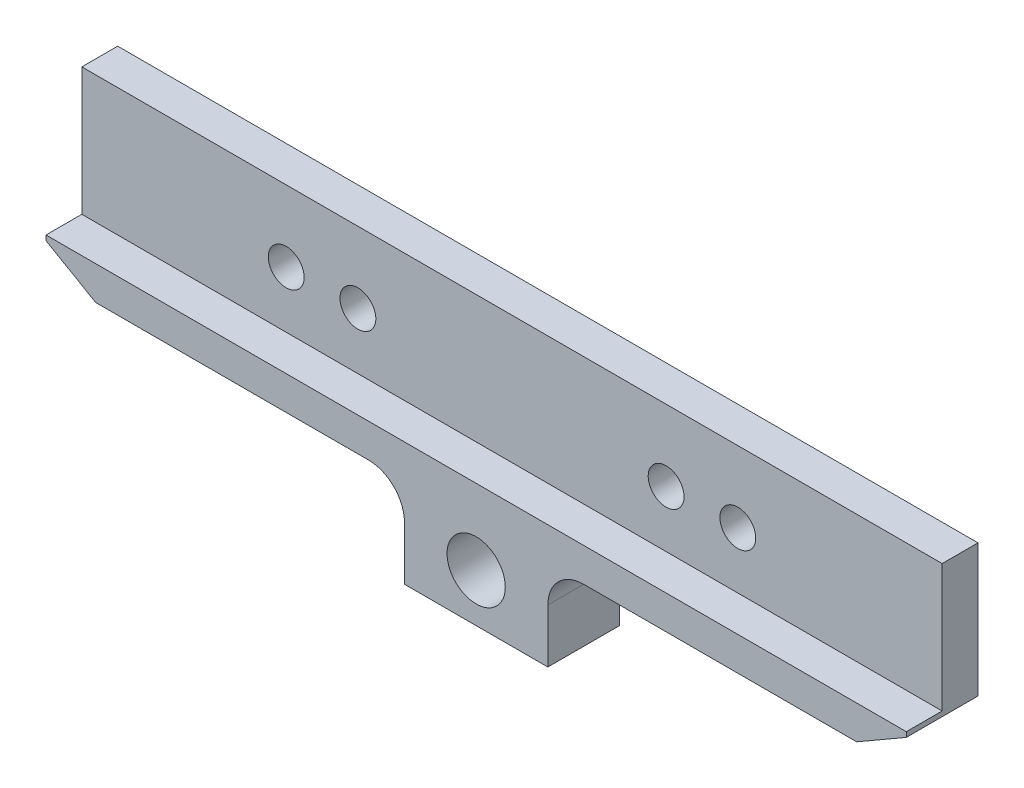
SolidWorks part; units mm, degrees
ref_plane "Front" through (0, 0, 0) normal (0, 0, 1) x (1, 0, 0)
ref_plane "Top" through (0, 0, 0) normal (0, 1, 0) x (1, 0, 0)
ref_plane "Right" through (0, 0, 0) normal (1, 0, 0) x (0, 0, -1)
sketch "Sketch1" plane through (0, 0, 0) normal (0, 0, 1) x (1, 0, 0)
  line L0 (-38.1, 0) -> (38.1, 0)
  line L1 (-38.1, 0) -> (-38.1, -14.8533)
  line L2 (38.1, 0) -> (38.1, -14.8533)
  line L3 (0, 0) -> (0, -25.4) construction
  arc A0 (-38.1, -14.8533) -> (38.1, -14.8533) centre (0, 48.6918) ccw
  circle A1 centre (0, -17.9832) radius 2.5794
  circle A2 centre (13.65, -6.3082) radius 1.5881
  circle A3 centre (20, -6.3082) radius 1.5881
  circle A4 centre (-20, -6.3082) radius 1.5881
  circle A5 centre (-13.65, -6.3082) radius 1.5881
  dimension "D1" = 148.1836
  dimension "D3" = 5.1587
  dimension "D6" = 3.1763
  dimension "D2" = 25.4
  dimension "D4" = 66.675
  dimension "D5" = 38.1
  dimension "D7" = 6.3082
  dimension "D8" = 20
  dimension "D9" = 20
  dimension "D10" = 6.35
  dimension "D11" = 33.65
extrude "Boss-Extrude1" add sketch "Sketch1" along normal mid plane 6.35
sketch "Sketch2" plane through (0, 0, 3.175) normal (0, 0, 1) x (1, 0, 0)
  line L1 (40, -11.3082) -> (-40, -11.3082)
  line L2 (38.1, 0) -> (-38.1, 0) construction
  line L3 (-40, -11.3082) -> (-40, 5.1343)
  line L4 (-40, 5.1343) -> (40, 5.1343)
  line L5 (40, 5.1343) -> (40, -11.3082)
  dimension "D1" = 11.3082
extrude "Cut-Extrude1" cut sketch "Sketch2" against normal blind 3.175
sketch "Sketch3" plane through (0, 0, -3.175) normal (0, 0, -1) x (-1, 0, 0)
  line L0 (0, 0) -> (0, -28.4602) construction
  line L1 (-42.9143, -17.46) -> (-19.05, -17.46)
  line L2 (-42.9143, -17.46) -> (-42.9143, -31.0618)
  line L3 (-42.9143, -31.0618) -> (-19.05, -31.0618)
  line L4 (-19.05, -17.46) -> (-19.05, -31.0618)
  line L5 (-12.7, -27.6457) -> (-6.35, -27.6457)
  line L6 (-12.7, -27.6457) -> (-12.7, -20.8855)
  line L7 (-12.7, -20.8855) -> (-6.35, -20.8855)
  line L8 (-6.35, -27.6457) -> (-6.35, -20.8855)
  line L9 (-38.1, 0) -> (38.1, 0) construction
  line L10 (6.35, -27.6457) -> (6.35, -20.8855)
  line L11 (12.7, -20.8855) -> (6.35, -20.8855)
  line L12 (12.7, -27.6457) -> (12.7, -20.8855)
  line L13 (12.7, -27.6457) -> (6.35, -27.6457)
  line L14 (19.05, -17.46) -> (19.05, -31.0618)
  line L15 (42.9143, -31.0618) -> (19.05, -31.0618)
  line L16 (42.9143, -17.46) -> (42.9143, -31.0618)
  line L17 (42.9143, -17.46) -> (19.05, -17.46)
  dimension "D1" = 6.35
  dimension "D2" = 6.35
  dimension "D3" = 6.35
  dimension "D4" = 17.46
extrude "Cut-Extrude2" cut sketch "Sketch3" against normal through all
fillet "Fillet2" radius 1.5875 6 edges at (-19.05, -17.46, 0) (-6.35, -20.8855, 0) (12.7, -20.8855, 0) (-12.7, -20.8855, 0) (6.35, -20.8855, 0) (19.05, -17.46, 0)
sketch "Sketch4" plane through (0, 0, -3.175) normal (0, 0, -1) x (-1, 0, 0)
  line L13 (19.05, -22.9091) -> (19.05, -19.0475)
  line L14 (20.6375, -17.46) -> (33.3697, -17.46)
  line L15 (38.1, -14.8533) -> (38.1, 0)
  line L16 (38.1, 0) -> (-38.1, 0)
  line L17 (-38.1, 0) -> (-38.1, -14.8533)
  line L18 (-33.3697, -17.46) -> (-20.6375, -17.46)
  line L19 (-19.05, -19.0475) -> (-19.05, -22.9091)
  line L20 (-12.7, -24.3034) -> (-12.7, -22.473)
  line L21 (-11.1125, -20.8855) -> (-7.9375, -20.8855)
  line L22 (-6.35, -22.473) -> (-6.35, -25.1274)
  line L23 (6.35, -25.1274) -> (6.35, -22.473)
  line L24 (7.9375, -20.8855) -> (11.1125, -20.8855)
  line L25 (12.7, -22.473) -> (12.7, -24.3034)
  line L26 (19.05, -22.9091) -> (19.05, -19.0475)
  line L27 (20.6375, -17.46) -> (33.3697, -17.46)
  line L31 (-33.3697, -17.46) -> (-20.6375, -17.46)
  line L32 (-19.05, -19.0475) -> (-19.05, -22.9091)
  line L33 (-12.7, -24.3034) -> (-12.7, -22.473)
  line L34 (-11.1125, -20.8855) -> (-7.9375, -20.8855)
  line L35 (-6.35, -22.473) -> (-6.35, -25.1274)
  line L36 (6.35, -25.1274) -> (6.35, -22.473)
  line L37 (7.9375, -20.8855) -> (11.1125, -20.8855)
  line L38 (12.7, -22.473) -> (12.7, -24.3034)
  arc A0 (-33.3697, -17.46) -> (-19.05, -22.9091) centre (0, 48.6918) ccw
  arc A1 (-12.7, -24.3034) -> (-6.35, -25.1274) centre (0, 48.6918) ccw
  arc A2 (6.35, -25.1274) -> (12.7, -24.3034) centre (0, 48.6918) ccw
  arc A3 (19.05, -22.9091) -> (33.3697, -17.46) centre (0, 48.6918) ccw
  arc A12 (20.6375, -17.46) -> (19.05, -19.0475) centre (20.6375, -19.0475) ccw
  arc A13 (33.3697, -17.46) -> (38.1, -14.8533) centre (0, 48.6918) ccw
  arc A14 (-38.1, -14.8533) -> (-33.3697, -17.46) centre (0, 48.6918) ccw
  arc A15 (-19.05, -19.0475) -> (-20.6375, -17.46) centre (-20.6375, -19.0475) ccw
  arc A16 (-19.05, -22.9091) -> (-12.7, -24.3034) centre (0, 48.6918) ccw
  arc A17 (-11.1125, -20.8855) -> (-12.7, -22.473) centre (-11.1125, -22.473) ccw
  arc A18 (-6.35, -22.473) -> (-7.9375, -20.8855) centre (-7.9375, -22.473) ccw
  arc A19 (-6.35, -25.1274) -> (6.35, -25.1274) centre (0, 48.6918) ccw
  arc A20 (7.9375, -20.8855) -> (6.35, -22.473) centre (7.9375, -22.473) ccw
  arc A21 (12.7, -22.473) -> (11.1125, -20.8855) centre (11.1125, -22.473) ccw
  arc A22 (12.7, -24.3034) -> (19.05, -22.9091) centre (0, 48.6918) ccw
  arc A23 (20.6375, -17.46) -> (19.05, -19.0475) centre (20.6375, -19.0475) ccw
  arc A26 (-19.05, -19.0475) -> (-20.6375, -17.46) centre (-20.6375, -19.0475) ccw
  arc A28 (-11.1125, -20.8855) -> (-12.7, -22.473) centre (-11.1125, -22.473) ccw
  arc A29 (-6.35, -22.473) -> (-7.9375, -20.8855) centre (-7.9375, -22.473) ccw
  arc A31 (7.9375, -20.8855) -> (6.35, -22.473) centre (7.9375, -22.473) ccw
  arc A32 (12.7, -22.473) -> (11.1125, -20.8855) centre (11.1125, -22.473) ccw
  dimension "D1" = 0
extrude "Boss-Extrude2" add sketch "Sketch4" against normal up to surface (6.35 mm away)
sketch "Sketch5" plane through (0, 0, -3.175) normal (0, 0, -1) x (-1, 0, 0)
  line L0 (0, 0) -> (0, -22.225) construction
  line L1 (6.35, -22.225) -> (-6.35, -22.225)
  line L2 (33.7006, -14.2875) -> (38.1, -11.7475)
  line L3 (38.1, 0) -> (-38.1, 0) construction
  line L4 (-6.35, -22.225) -> (-6.35, -17.4625)
  line L5 (-9.525, -14.2875) -> (-33.7006, -14.2875)
  line L6 (-33.7006, -14.2875) -> (-38.1, -11.7475)
  line L7 (-38.1, -14.8533) -> (-38.1, -11.3082) construction
  line L8 (9.525, -14.2875) -> (33.7006, -14.2875)
  line L9 (6.35, -22.225) -> (6.35, -17.4625)
  line L10 (38.1, -11.3082) -> (38.1, -14.8533) construction
  line L11 (38.1, -11.7475) -> (38.1, -14.8533)
  line L12 (-38.1, -14.8533) -> (-38.1, -11.7475)
  arc A2 (-38.1, -14.8533) -> (38.1, -14.8533) centre (0, 48.6918) ccw construction
  arc A3 (-38.1, -14.8533) -> (38.1, -14.8533) centre (0, 48.6918) ccw
  arc A4 (9.525, -14.2875) -> (6.35, -17.4625) centre (9.525, -17.4625) ccw
  arc A5 (-9.525, -14.2875) -> (-6.35, -17.4625) centre (-9.525, -17.4625) cw
  point P18 (0, -22.225)
  point P23 (6.35, -14.2875)
  point P26 (-6.35, -14.2875)
  dimension "D1" = 11.7475
  dimension "D6" = 3.175
  dimension "D2" = 22.225
  dimension "D3" = 14.2875
  dimension "D4" = 30
  dimension "D5" = 6.35
extrude "Cut-Extrude3" cut sketch "Sketch5" against normal through all
